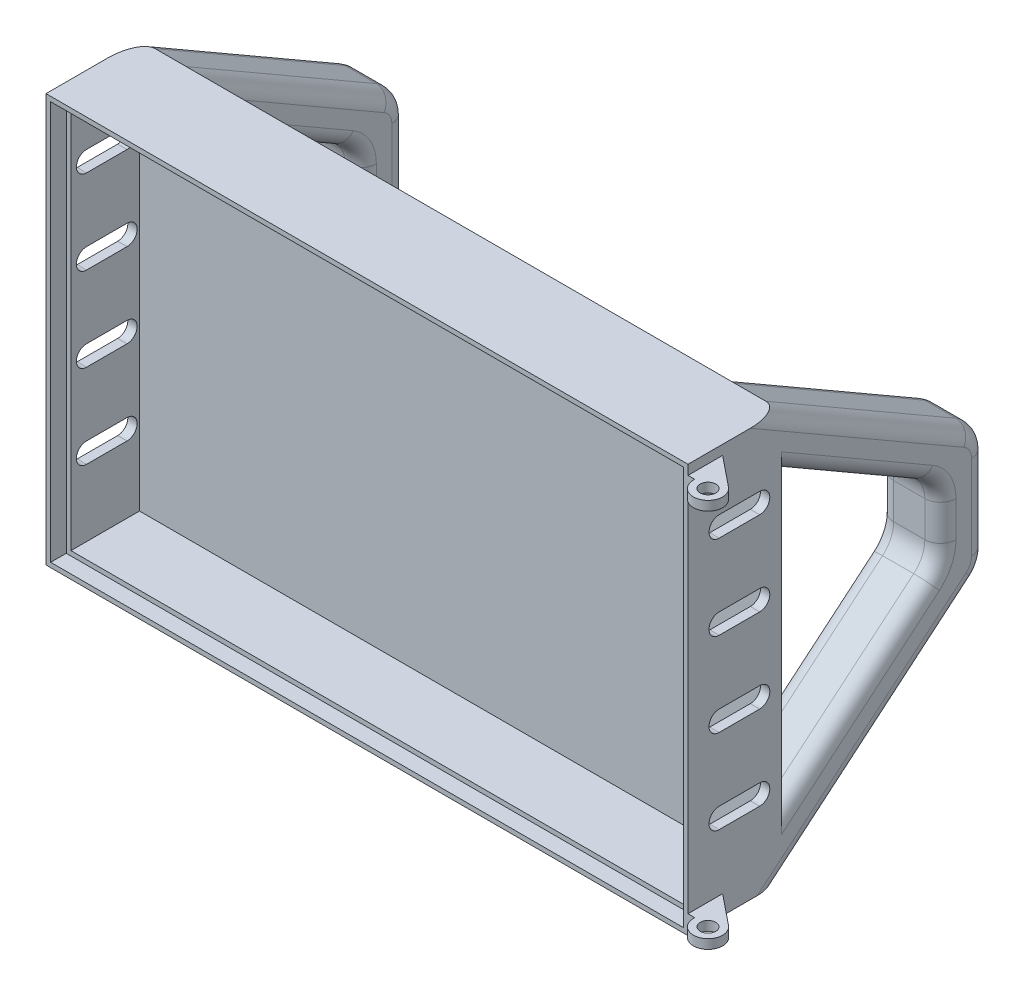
SolidWorks part; units mm, degrees
ref_plane "Front Plane" through (0, 0, 0) normal (0, 0, 1) x (1, 0, 0)
ref_plane "Top Plane" through (0, 0, 0) normal (0, 1, 0) x (1, 0, 0)
ref_plane "Right Plane" through (0, 0, 0) normal (1, 0, 0) x (0, 0, -1)
sketch "Sketch1" plane through (0, 0, 0) normal (0, 0, 1) x (1, 0, 0)
  line L1 (-103, 131) -> (103, 131)
  line L2 (-103, 131) -> (-103, 0)
  line L3 (-103, 0) -> (103, 0)
  line L4 (103, 131) -> (103, 0)
  point P4 (0, 0)
  dimension "D1" = 131
  dimension "D2" = 206
extrude "Boss-Extrude1" add sketch "Sketch1" along normal blind 30
shell "Shell1" thickness 3
sketch "Sketch3" plane through (-103, 0, 0) normal (-1, 0, 0) x (0, 0, 1)
  line L3 (0, 0) -> (-87.6036, 0) construction
  line L4 (30, 131) -> (0, 131) construction
  line L11 (0, 131) -> (0, 0) construction
  line L12 (30, 0) -> (0, 0) construction
  line L17 (15, 131) -> (15, -27.5726) construction
  line L20 (0, 19.5811) -> (0, 0)
  line L21 (0, 0) -> (-62.4279, 52.3832)
  line L22 (-66, 60.0437) -> (-66, 87.1214)
  line L23 (-61, 95.7816) -> (0, 131)
  line L24 (0, 131) -> (0, 113.6795)
  line L25 (-46, 87.1214) -> (0, 113.6795)
  line L26 (-51, 67.0383) -> (-51, 78.4611)
  line L27 (0, 19.5811) -> (-47.4279, 59.3778)
  arc A4 (-66, 60.0437) -> (-62.4279, 52.3832) centre (-56, 60.0437) ccw
  arc A5 (-66, 87.1214) -> (-61, 95.7816) centre (-56, 87.1214) cw
  arc A6 (-51, 78.4611) -> (-46, 87.1214) centre (-41, 78.4611) cw
  arc A7 (-51, 67.0383) -> (-47.4279, 59.3778) centre (-41, 67.0383) ccw
  dimension "D5" = 19.5811
  dimension "D1" = 10
  dimension "D2" = 41
  dimension "D4" = 47.4279
  dimension "D3" = 46
  dimension "D7" = 61
  dimension "D8" = 62.4279
extrude "Boss-Extrude2" add sketch "Sketch3" against normal blind 20
sketch "Sketch4" plane through (103, 0, 0) normal (1, 0, 0) x (0, 0, -1)
  line L8 (0, 0) -> (62.4279, 52.3832)
  line L9 (66, 60.0437) -> (66, 87.1214)
  line L10 (61, 95.7816) -> (0, 131)
  line L11 (0, 131) -> (0, 113.6795)
  line L12 (0, 113.6795) -> (46, 87.1214)
  line L13 (51, 78.4611) -> (51, 67.0383)
  line L14 (47.4279, 59.3778) -> (0, 19.5811)
  line L15 (0, 19.5811) -> (0, 0)
  line L16 (0, 0) -> (62.4279, 52.3832)
  line L17 (66, 60.0437) -> (66, 87.1214)
  line L18 (61, 95.7816) -> (0, 131)
  line L19 (0, 131) -> (0, 113.6795)
  line L20 (0, 113.6795) -> (46, 87.1214)
  line L21 (51, 78.4611) -> (51, 67.0383)
  line L22 (47.4279, 59.3778) -> (0, 19.5811)
  line L23 (0, 19.5811) -> (0, 0)
  arc A4 (62.4279, 52.3832) -> (66, 60.0437) centre (56, 60.0437) ccw
  arc A5 (66, 87.1214) -> (61, 95.7816) centre (56, 87.1214) ccw
  arc A6 (51, 78.4611) -> (46, 87.1214) centre (41, 78.4611) ccw
  arc A7 (47.4279, 59.3778) -> (51, 67.0383) centre (41, 67.0383) ccw
  arc A8 (62.4279, 52.3832) -> (66, 60.0437) centre (56, 60.0437) ccw
  arc A9 (66, 87.1214) -> (61, 95.7816) centre (56, 87.1214) ccw
  arc A10 (51, 78.4611) -> (46, 87.1214) centre (41, 78.4611) ccw
  arc A11 (47.4279, 59.3778) -> (51, 67.0383) centre (41, 67.0383) ccw
  dimension "D1" = 0
extrude "Boss-Extrude3" add sketch "Sketch4" against normal blind 20
fillet "Fillet1" radius 5 20 edges at (-83, 26.1916, -31.2139) (-83, 55.8175, -65.0631) (-83, 73.5825, -66) (-83, 92.1214, -64.6603) (-103, 26.1916, -31.2139) (-103, 55.8175, -65.0631) (-103, 73.5825, -66) (-103, 92.1214, -64.6603) (83, 26.1916, -31.2139) (83, 55.8175, -65.0631) (83, 73.5825, -66) (83, 92.1214, -64.6603) (103, 26.1916, -31.2139) (103, 55.8175, -65.0631) (103, 73.5825, -66) (103, 92.1214, -64.6603) (-83, 113.3908, -30.5) (-103, 113.3908, -30.5) (83, 113.3908, -30.5) (103, 113.3908, -30.5)
fillet "Fillet2" radius 5 20 edges at (-103, 100.4004, -23) (-83, 100.4004, -23) (-103, 83.4611, -49.6603) (-83, 83.4611, -49.6603) (-103, 72.7497, -51) (-83, 72.7497, -51) (-103, 62.8121, -50.0631) (-83, 62.8121, -50.0631) (-83, 39.4795, -23.7139) (83, 100.4004, -23) (83, 83.4611, -49.6603) (83, 72.7497, -51) (83, 62.8121, -50.0631) (103, 39.4795, -23.7139) (103, 62.8121, -50.0631) (103, 72.7497, -51) (103, 83.4611, -49.6603) (-103, 39.4795, -23.7139) (83, 39.4795, -23.7139) (103, 100.4004, -23)
sketch "Sketch5" plane through (0, 0, 30) normal (0, 0, 1) x (1, 0, 0)
  line L11 (-100, 128) -> (100, 128)
  line L12 (-100, 128) -> (-100, 3)
  line L13 (-100, 3) -> (100, 3)
  line L14 (-101.5, 129.5) -> (-101.5, 1.5)
  line L15 (-101.5, 1.5) -> (101.5, 1.5)
  line L16 (101.5, 1.5) -> (101.5, 129.5)
  line L17 (101.5, 129.5) -> (-101.5, 129.5)
  line L18 (-101.5, 129.5) -> (-101.5, 1.5)
  line L19 (-101.5, 1.5) -> (101.5, 1.5)
  line L20 (101.5, 1.5) -> (101.5, 129.5)
  line L21 (101.5, 129.5) -> (-101.5, 129.5)
  line L22 (100, 128) -> (100, 3)
  dimension "D1" = 1.5
extrude "Cut-Extrude1" cut sketch "Sketch5" against normal blind 5
sketch "Sketch6" plane through (0, 0, 0) normal (0, -1, 0) x (1, 0, 0)
  line L0 (113.0326, 26.9829) -> (103, 18.8893)
  line L1 (103, 30) -> (103, 7.7786) construction
  line L3 (103, 30) -> (105.18, 30)
  line L4 (105.18, 30) -> (105.18, 30.4238)
  line L5 (103, 30) -> (103, 18.8893)
  line L6 (-103, 30) -> (-103, 7.7786) construction
  line L7 (-88, 0) -> (88, 0) construction
  circle A2 centre (109.8539, 30.4238) radius 2.5
  arc A3 (112.7886, 26.7861) -> (105.18, 30.4238) centre (109.8539, 30.4238) ccw
  dimension "D1" = 5
  dimension "D2" = 9.3478
  dimension "D3" = 2.18
  dimension "D4" = 215.7886
  dimension "D5" = 216.0326
extrude "Boss-Extrude4" add sketch "Sketch6" against normal blind 3 from offset 3.1 contours L0 A3 L4 L3 A2 M11
sketch "Sketch7" plane through (0, 131, 0) normal (0, 1, 0) x (1, 0, 0)
  line L13 (112.7886, -26.7861) -> (103, -18.8893)
  line L14 (103, -18.8893) -> (103, -30)
  line L15 (103, -30) -> (105.18, -30)
  line L16 (105.18, -30) -> (105.18, -30.4238)
  line L17 (112.7886, -26.7861) -> (103, -18.8893)
  line L18 (103, -18.8893) -> (103, -30)
  line L19 (103, -30) -> (105.18, -30)
  line L20 (105.18, -30) -> (105.18, -30.4238)
  circle A3 centre (109.8539, -30.4238) radius 2.5
  arc A4 (105.18, -30.4238) -> (112.7886, -26.7861) centre (109.8539, -30.4238) ccw
  arc A5 (105.18, -30.4238) -> (112.7886, -26.7861) centre (109.8539, -30.4238) ccw
  dimension "D2" = 5
  dimension "D1" = 0
extrude "Boss-Extrude5" add sketch "Sketch7" against normal blind 3 from offset 3.1
sketch "Sketch8" plane through (-103, 0, 0) normal (-1, 0, 0) x (0, 0, 1)
  line L0 (7, 108.7214) -> (20, 108.7214) construction
  line L1 (7, 111.9714) -> (20, 111.9714)
  line L2 (7, 105.4714) -> (20, 105.4714)
  line L3 (7, 81.7214) -> (20, 81.7214) construction
  line L4 (7, 84.9714) -> (20, 84.9714)
  line L5 (7, 78.4714) -> (20, 78.4714)
  line L6 (7, 54.7214) -> (20, 54.7214) construction
  line L7 (7, 57.9714) -> (20, 57.9714)
  line L8 (7, 51.4714) -> (20, 51.4714)
  line L9 (7, 27.7214) -> (20, 27.7214) construction
  line L10 (7, 30.9714) -> (20, 30.9714)
  line L11 (7, 24.4714) -> (20, 24.4714)
  line L12 (30, 131) -> (30, 0) construction
  line L13 (30, 131) -> (10, 131) construction
  arc A0 (7, 111.9714) -> (7, 105.4714) centre (7, 108.7214) ccw
  arc A1 (20, 105.4714) -> (20, 111.9714) centre (20, 108.7214) ccw
  arc A2 (7, 84.9714) -> (7, 78.4714) centre (7, 81.7214) ccw
  arc A3 (20, 78.4714) -> (20, 84.9714) centre (20, 81.7214) ccw
  arc A4 (7, 57.9714) -> (7, 51.4714) centre (7, 54.7214) ccw
  arc A5 (20, 51.4714) -> (20, 57.9714) centre (20, 54.7214) ccw
  arc A6 (7, 30.9714) -> (7, 24.4714) centre (7, 27.7214) ccw
  arc A7 (20, 24.4714) -> (20, 30.9714) centre (20, 27.7214) ccw
  point P2 (13.5, 108.7214)
  point P10 (13.5, 81.7214)
  point P17 (13.5, 54.7214)
  point P24 (13.5, 27.7214)
  dimension "D2" = 6.5
  dimension "D3" = 13
  dimension "D4" = 10
  dimension "D5" = 22.2786
  dimension "D6" = 27
  dimension "D1" = 4
extrude "Cut-Extrude2" cut sketch "Sketch8" against normal blind 230
sketch "Sketch9" plane through (-103, 0, 0) normal (-1, 0, 0) x (0, 0, 1)
  line L0 (7, 24.4714) -> (20, 24.4714) construction
  line L1 (23.1258, 70.6343) -> (21.5766, 70.6343)
  line L2 (23.1258, 70.6343) -> (23.1258, 59.4527)
  line L3 (23.1258, 59.4527) -> (21.5766, 59.4527)
  line L4 (21.5766, 70.6343) -> (21.5766, 59.4527)
  dimension "D1" = 14.5766
  dimension "D2" = 16.1258
  dimension "D3" = 34.9814
  dimension "D4" = 46.1629
extrude "Cut-Extrude3" cut sketch "Sketch9" against normal blind 0.5
chamfer "Chamfer1" distance 0.3 angle 45 1 edges at (-103, 65.0435, 21.5766)
fillet "Fillet3" radius 0.1 1 edges at (-103, 65.0435, 23.1258)
